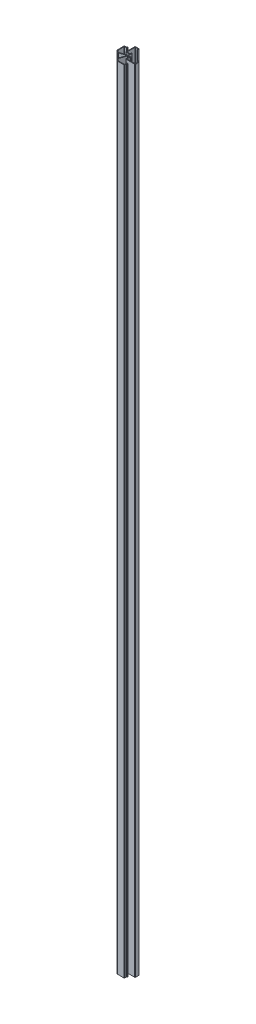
SolidWorks part; units mm, degrees
ref_plane "Plan de face" through (0, 0, 0) normal (0, 0, 1) x (1, 0, 0)
ref_plane "Plan de dessus" through (0, 0, 0) normal (0, 1, 0) x (1, 0, 0)
ref_plane "Plan de droite" through (0, 0, 0) normal (1, 0, 0) x (0, 0, -1)
sketch "Esquisse1" plane through (0, 0, 0) normal (0, 1, 0) x (1, 0, 0)
  line L0 (0, 0) -> (5.25, 0)
  line L1 (12.65, 0) -> (14.7, 0)
  line L2 (15.5, -0.8) -> (15.5, -5.3)
  line L3 (12.35, -0.3) -> (12.35, -0.55)
  line L4 (12.65, -0.85) -> (14.15, -0.85)
  line L5 (14.65, -1.35) -> (14.65, -4.75)
  line L6 (-9.8472, -3.9947) -> (-0.6456, -0.6456)
  line L7 (14.7, -6.1) -> (3.197, -6.1)
  line L8 (5.55, -0.3) -> (5.55, -0.55)
  line L9 (5.25, -0.85) -> (3.75, -0.85)
  line L10 (14.15, -5.25) -> (3.75, -5.25)
  line L11 (3.25, -1.35) -> (3.25, -4.75)
  line L12 (2.397, -5.3) -> (2.397, -1.35)
  line L13 (9.7, -10.1) -> (8.8, -10.1)
  line L14 (10, -10.4) -> (10, -10.65)
  line L15 (9.7, -10.95) -> (9.35, -10.95)
  line L16 (8.85, -13.6) -> (8.85, -11.45)
  line L17 (8.05, -14.4) -> (-0.4074, -14.4)
  line L18 (8, -13.05) -> (8, -10.9)
  line L19 (-2.5287, -13.5213) -> (-8.025, -8.025)
  line L20 (0, 0) -> (-10.8535, -10.8535) construction
  line L21 (-3.6, -3.6438) -> (-3.6, -11.2479) construction
  line L22 (7.5, -13.55) -> (-1.0908, -13.55)
  line L23 (-1.4444, -13.4036) -> (-3.3748, -11.4732)
  line L24 (-3.4911, -10.9486) -> (0.0648, -1.179)
  line L25 (0.5346, -0.85) -> (1.897, -0.85)
  line L26 (-4.8181, -10.0298) -> (-7.424, -7.424)
  line L27 (-3.9947, -9.8472) -> (-0.6456, -0.6456)
  line L28 (-10.9486, -3.4911) -> (-1.179, 0.0648)
  line L29 (-0.85, 0.5346) -> (-0.85, 1.897)
  line L30 (-13.55, 7.5) -> (-13.55, -1.0908)
  line L31 (-13.05, 8) -> (-10.9, 8)
  line L32 (-14.4, 8.05) -> (-14.4, -0.4074)
  line L33 (-13.6, 8.85) -> (-11.45, 8.85)
  line L34 (-10.95, 9.7) -> (-10.95, 9.35)
  line L35 (-10.4, 10) -> (-10.65, 10)
  line L36 (-10.1, 9.7) -> (-10.1, 8.8)
  line L37 (-5.3, 2.397) -> (-1.35, 2.397)
  line L38 (-1.35, 3.25) -> (-4.75, 3.25)
  line L39 (-5.25, 14.15) -> (-5.25, 3.75)
  line L40 (-0.85, 5.25) -> (-0.85, 3.75)
  line L41 (-0.3, 5.55) -> (-0.55, 5.55)
  line L42 (-6.1, 14.7) -> (-6.1, 3.197)
  line L43 (-1.35, 14.65) -> (-4.75, 14.65)
  line L44 (-0.85, 12.65) -> (-0.85, 14.15)
  line L45 (-0.3, 12.35) -> (-0.55, 12.35)
  line L46 (-0.8, 15.5) -> (-5.3, 15.5)
  line L47 (0, 12.65) -> (0, 14.7)
  line L48 (0, 0) -> (0, 5.25)
  line L49 (-13.5213, -2.5287) -> (-8.025, -8.025)
  line L50 (-7.424, -7.424) -> (-10.0298, -4.8181)
  line L51 (-11.4732, -3.3748) -> (-13.4036, -1.4444)
  arc A0 (-4.8181, -10.0298) -> (-3.9947, -9.8472) centre (-4.4646, -9.6762) ccw
  arc A1 (-3.3748, -11.4732) -> (-3.4911, -10.9486) centre (-3.0212, -11.1196) cw
  arc A2 (0.5346, -0.85) -> (0.0648, -1.179) centre (0.5346, -1.35) ccw
  arc A3 (-1.4444, -13.4036) -> (-1.0908, -13.55) centre (-1.0908, -13.05) ccw
  arc A4 (1.897, -0.85) -> (2.397, -1.35) centre (1.897, -1.35) cw
  arc A5 (3.75, -0.85) -> (3.25, -1.35) centre (3.75, -1.35) ccw
  arc A6 (14.15, -0.85) -> (14.65, -1.35) centre (14.15, -1.35) cw
  arc A7 (14.65, -4.75) -> (14.15, -5.25) centre (14.15, -4.75) cw
  arc A8 (3.75, -5.25) -> (3.25, -4.75) centre (3.75, -4.75) cw
  arc A9 (12.65, 0) -> (12.35, -0.3) centre (12.65, -0.3) ccw
  arc A10 (12.35, -0.55) -> (12.65, -0.85) centre (12.65, -0.55) ccw
  arc A11 (5.25, 0) -> (5.55, -0.3) centre (5.25, -0.3) cw
  arc A12 (5.55, -0.55) -> (5.25, -0.85) centre (5.25, -0.55) cw
  arc A13 (2.397, -5.3) -> (3.197, -6.1) centre (3.197, -5.3) ccw
  arc A14 (14.7, -6.1) -> (15.5, -5.3) centre (14.7, -5.3) ccw
  arc A15 (15.5, -0.8) -> (14.7, 0) centre (14.7, -0.8) ccw
  arc A16 (8.05, -14.4) -> (8.85, -13.6) centre (8.05, -13.6) ccw
  arc A17 (8, -10.9) -> (8.8, -10.1) centre (8.8, -10.9) cw
  arc A18 (7.5, -13.55) -> (8, -13.05) centre (7.5, -13.05) ccw
  arc A19 (8.85, -11.45) -> (9.35, -10.95) centre (9.35, -11.45) cw
  arc A20 (9.7, -10.95) -> (10, -10.65) centre (9.7, -10.65) ccw
  arc A21 (10, -10.4) -> (9.7, -10.1) centre (9.7, -10.4) ccw
  arc A22 (-2.5287, -13.5213) -> (-0.4074, -14.4) centre (-0.4074, -11.4) ccw
  arc A23 (-11.4732, -3.3748) -> (-10.9486, -3.4911) centre (-11.1196, -3.0212) ccw
  arc A24 (-13.4036, -1.4444) -> (-13.55, -1.0908) centre (-13.05, -1.0908) cw
  arc A25 (-13.5213, -2.5287) -> (-14.4, -0.4074) centre (-11.4, -0.4074) cw
  arc A26 (-10.0298, -4.8181) -> (-9.8472, -3.9947) centre (-9.6762, -4.4646) cw
  arc A27 (-10.4, 10) -> (-10.1, 9.7) centre (-10.4, 9.7) cw
  arc A28 (-10.95, 9.7) -> (-10.65, 10) centre (-10.65, 9.7) cw
  arc A29 (-11.45, 8.85) -> (-10.95, 9.35) centre (-11.45, 9.35) ccw
  arc A30 (-13.55, 7.5) -> (-13.05, 8) centre (-13.05, 7.5) cw
  arc A31 (-10.9, 8) -> (-10.1, 8.8) centre (-10.9, 8.8) ccw
  arc A32 (-14.4, 8.05) -> (-13.6, 8.85) centre (-13.6, 8.05) cw
  arc A33 (-0.8, 15.5) -> (0, 14.7) centre (-0.8, 14.7) cw
  arc A34 (-6.1, 14.7) -> (-5.3, 15.5) centre (-5.3, 14.7) cw
  arc A35 (-5.3, 2.397) -> (-6.1, 3.197) centre (-5.3, 3.197) cw
  arc A36 (-0.55, 5.55) -> (-0.85, 5.25) centre (-0.55, 5.25) ccw
  arc A37 (0, 5.25) -> (-0.3, 5.55) centre (-0.3, 5.25) ccw
  arc A38 (-0.55, 12.35) -> (-0.85, 12.65) centre (-0.55, 12.65) cw
  arc A39 (0, 12.65) -> (-0.3, 12.35) centre (-0.3, 12.65) cw
  arc A40 (-5.25, 3.75) -> (-4.75, 3.25) centre (-4.75, 3.75) ccw
  arc A41 (-4.75, 14.65) -> (-5.25, 14.15) centre (-4.75, 14.15) ccw
  arc A42 (-0.85, 14.15) -> (-1.35, 14.65) centre (-1.35, 14.15) ccw
  arc A43 (-0.85, 3.75) -> (-1.35, 3.25) centre (-1.35, 3.75) cw
  arc A44 (-0.85, 1.897) -> (-1.35, 2.397) centre (-1.35, 1.897) ccw
  arc A45 (-0.85, 0.5346) -> (-1.179, 0.0648) centre (-1.35, 0.5346) cw
  point P44 (3.25, -0.85)
  point P54 (12.35, 0)
  point P57 (12.35, -0.85)
  point P60 (5.55, 0)
  point P63 (5.55, -0.85)
  point P68 (15.5, -6.1)
  point P71 (15.5, 0)
  point P74 (8.85, -14.4)
  point P77 (8, -10.1)
  point P84 (10, -10.95)
  point P87 (10, -10.1)
  point P90 (-1.65, -14.4)
  point P158 (-10.1, 10)
  point P159 (-10.95, 10)
  point P160 (-10.1, 8)
  point P161 (-14.4, 8.85)
  point P162 (0, 15.5)
  point P163 (-6.1, 15.5)
  point P164 (-0.85, 5.55)
  point P165 (0, 5.55)
  point P166 (-0.85, 12.35)
  point P167 (0, 12.35)
  point P168 (-0.85, 3.25)
  dimension "D26" = 0.5
  dimension "D27" = 0.5
  dimension "D28" = 0.5
  dimension "D29" = 0.5
  dimension "D30" = 0.5
  dimension "D31" = 0.5
  dimension "D32" = 0.5
  dimension "D33" = 0.3
  dimension "D34" = 0.8
  dimension "D35" = 0.8
  dimension "D36" = 0.5
  dimension "D37" = 0.3
  dimension "D38" = 3
  dimension "D1" = 3.15
  dimension "D2" = 5.55
  dimension "D3" = 6.1
  dimension "D4" = 0.85
  dimension "D5" = 0.85
  dimension "D6" = 0.85
  dimension "D7" = 0.85
  dimension "D8" = 6.8
  dimension "D9" = 0.853
  dimension "D10" = 0.85
  dimension "D11" = 4
  dimension "D12" = 14.4
  dimension "D13" = 10.5
  dimension "D14" = 45
  dimension "D15" = 13.6
  dimension "D16" = 0.85
  dimension "D17" = 0.85
  dimension "D18" = 5.5
  dimension "D19" = 0.85
  dimension "D20" = 2
  dimension "D21" = 9.0156
  dimension "D22" = 2.3
  dimension "D23" = 0.85
  dimension "D24" = 0.85
  dimension "D25" = 70
extrude "Boss.-Extru.1" add sketch "Esquisse1" along normal blind 1100
fillet "Congé1" radius 0.5 1 edges at (-0.6456, 550, 0.6456)
